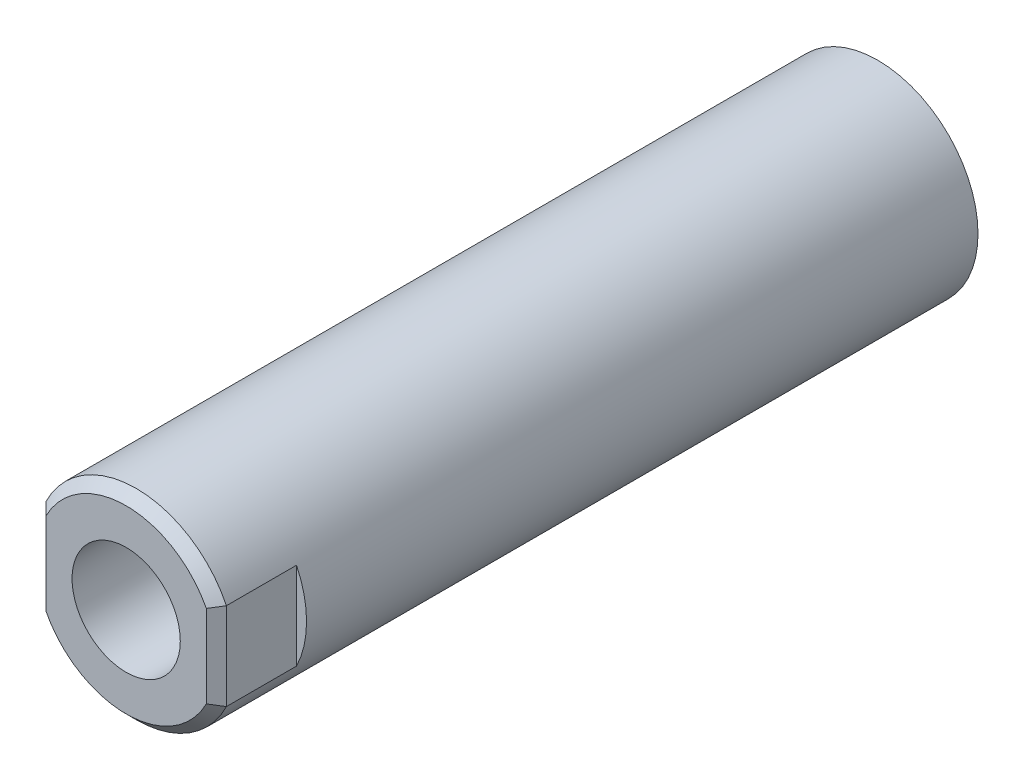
SolidWorks part; units mm, degrees
ref_plane "Front Plane" through (0, 0, 0) normal (0, 0, 1) x (1, 0, 0)
ref_plane "Top Plane" through (0, 0, 0) normal (0, 1, 0) x (1, 0, 0)
ref_plane "Right Plane" through (0, 0, 0) normal (1, 0, 0) x (0, 0, -1)
sketch "Sketch1" plane through (0, 0, 0) normal (0, 0, 1) x (1, 0, 0)
  circle A0 centre (0, 0) radius 10
  dimension "D1" = 20
extrude "S" add sketch "Sketch1" against normal blind 75
sketch "Sketch2" plane through (0, 0, 0) normal (0, 0, 1) x (1, 0, 0)
  circle A0 centre (0, 0) radius 10
  circle A1 centre (0, 0) radius 10 construction
  dimension "D1" = 20
sketch "Sketch7" plane through (0, 0, 0) normal (0, 1, 0) x (1, 0, 0)
  line L1 (9, 0) -> (11.5, 0)
  line L2 (9, 0) -> (9, 8)
  line L3 (9, 8) -> (11.5, 8)
  line L4 (11.5, 0) -> (11.5, 8)
  line L5 (-11.5, 0) -> (-9, 0)
  line L6 (-11.5, 0) -> (-11.5, 8)
  line L7 (-11.5, 8) -> (-9, 8)
  line L8 (-9, 0) -> (-9, 8)
  line L12 (0, 75) -> (0, 0) construction
  line L13 (-10, 75) -> (10, 75) construction
  line L14 (0, 0) -> (0, -11) construction
  dimension "D1" = 8
  dimension "D2" = 18
  dimension "D3" = 9
  dimension "D4" = 23
  dimension "D5" = 11.5
  dimension "D6" = 20
extrude "A/F" cut sketch "Sketch7" against normal mid plane 21
hole_wizard "M12x1.25 Tapped Hole1" positions "Sketch10" profile "Sketch9" tap size "M12x1.25" standard "Ansi Metric"
sketch "Sketch10" plane through (0, 0, 0) normal (0, 0, 1) x (1, 0, 0)
  point P0 (0, 0)
sketch "Sketch9" plane through (0, 0, 0) normal (1, 0, 0) x (0, -1, 0)
  line L0 (0, 0) -> (0, 27.9946)
  line L1 (0, 27.9946) -> (5.4, 24.75)
  line L2 (5.4, 24.75) -> (5.4, 0)
  line L5 (5.4, 0) -> (0, 0)
  line L10 (0, 27.9946) -> (-5.4, 24.75) construction
  line L11 (0, -6.35) -> (0, 107.95) construction
  dimension "Tap Drill Dia." = 10.8
  dimension "Tap Drill Depth" = 24.75
  dimension "Drill Angle" = 118
chamfer "Chamfer1" distance 1 angle 45 4 edges at (9, 0, 0) (0, -10, 0) (0, 10, 0) (-9, 0, 0)
equation "\"D2@Sketch6\" =\"D3@Sketch6\" - 1"
equation "\"D1@Sketch6\" = \"D3@Sketch6\""
equation "\"D2@Sketch7\" = \"D6@Sketch7\" - 2"
equation "\"D3@Sketch7\" = \"D2@Sketch7\" / 2"
equation "\"D4@Sketch7\" = \"D2@Sketch7\"+5"
equation "\"D5@Sketch7\" = \"D4@Sketch7\"/2"
equation "\"D1@Sketch7\" = \"D7@Sketch7\"-3"
